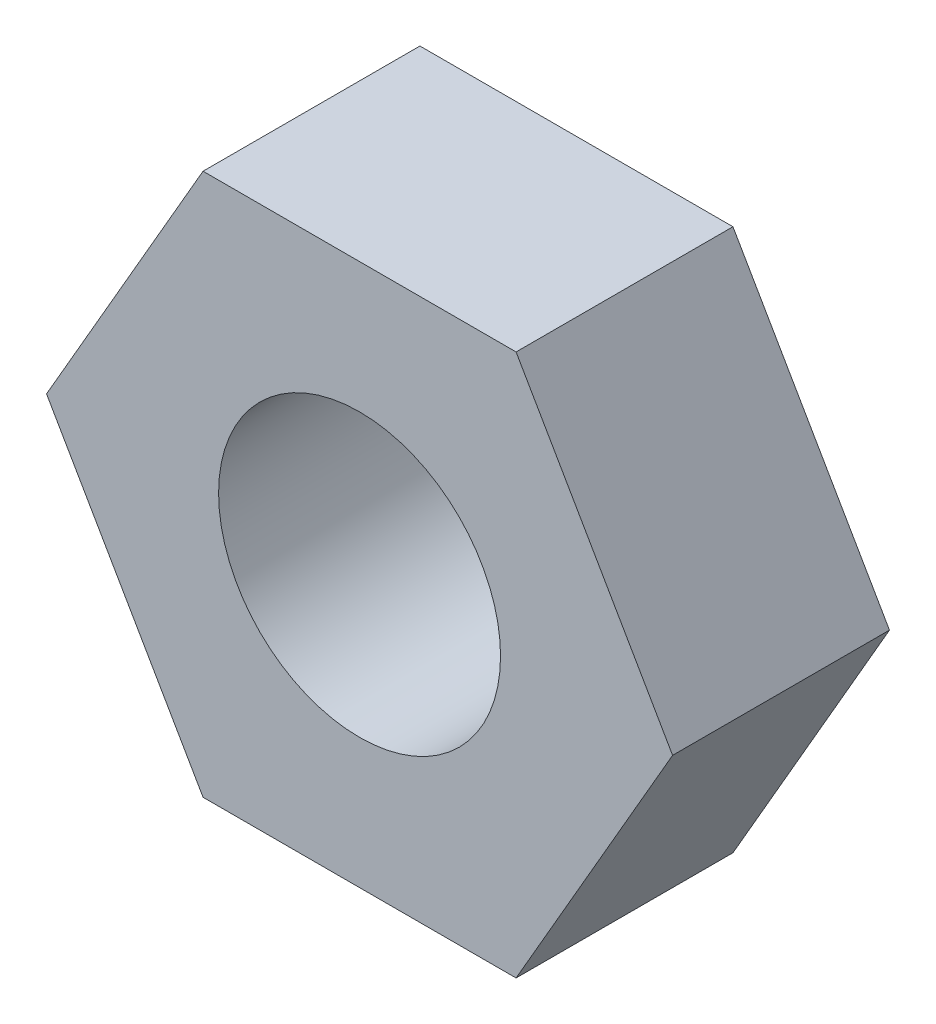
SolidWorks part; units mm, degrees
ref_plane "Front Plane" through (0, 0, 0) normal (0, 0, 1) x (1, 0, 0)
ref_plane "Top Plane" through (0, 0, 0) normal (0, 1, 0) x (1, 0, 0)
ref_plane "Right Plane" through (0, 0, 0) normal (1, 0, 0) x (0, 0, -1)
sketch "Sketch1" plane through (0, 0, 0) normal (0, 0, 1) x (1, 0, 0)
  line L1 (3.6662, 0) -> (1.8331, 3.175)
  line L2 (1.8331, 3.175) -> (-1.8331, 3.175)
  line L3 (-1.8331, 3.175) -> (-3.6662, 0)
  line L4 (-3.6662, 0) -> (-1.8331, -3.175)
  line L5 (-1.8331, -3.175) -> (1.8331, -3.175)
  line L6 (1.8331, -3.175) -> (3.6662, 0)
  circle A0 centre (0, 0) radius 1.651
  circle A1 centre (0, 0) radius 3.175 construction
  dimension "D1" = 3.302
  dimension "D2" = 6.35
extrude "Boss-Extrude1" add sketch "Sketch1" along normal blind 2.54
